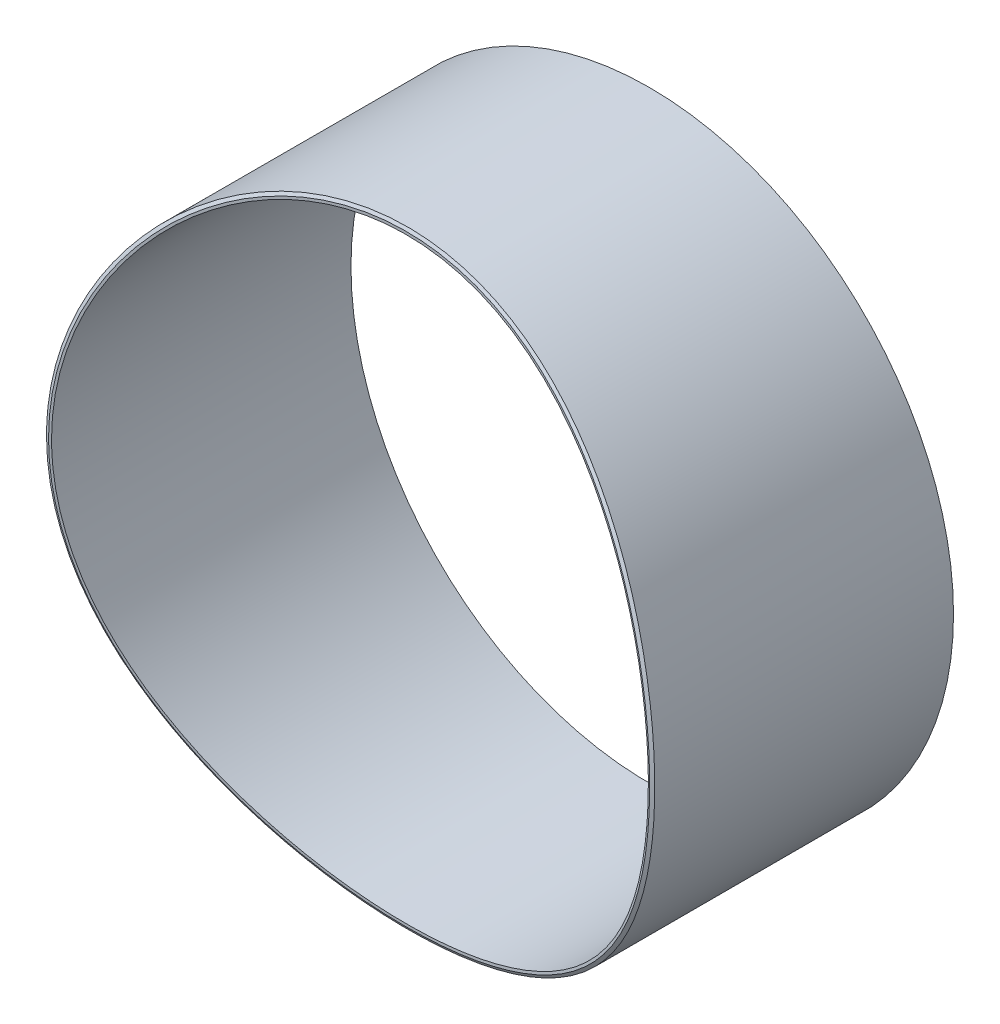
SolidWorks part; units mm, degrees
ref_plane "Front" through (0, 0, 0) normal (0, 0, 1) x (1, 0, 0)
ref_plane "Top" through (0, 0, 0) normal (0, 1, 0) x (1, 0, 0)
ref_plane "Right" through (0, 0, 0) normal (1, 0, 0) x (0, 0, -1)
sketch "Sketch1" plane through (0, 0, 0) normal (0, 0, 1) x (1, 0, 0)
  circle A0 centre (0, 0) radius 254
  circle A1 centre (0, 0) radius 249.2375
  dimension "D1" = 508
  dimension "D2" = 4.7625
extrude "Extrude1" add sketch "Sketch1" along normal blind 508
sketch "Sketch2" plane through (0, 0, 0) normal (0, 1, 0) x (1, 0, 0)
  line L2 (0, 182.5087) -> (0, -889) construction
  circle A0 centre (0, -889) radius 685.8
  point P0 (0, -203.2)
extrude "Cut-Extrude1" cut sketch "Sketch2" against normal through all and the other way through all
sketch "Sketch3" plane through (0, 0, 0) normal (1, 0, 0) x (0, 0, -1)
  line L0 (-4.1377, -254) -> (0, -250.825)
  line L1 (-203.2, -254) -> (0, -254) construction
  line L2 (0, -254) -> (0, 254) construction
  line L3 (0, -250.825) -> (0, -254)
  line L4 (0, -254) -> (-4.1377, -254)
  line L5 (35.2273, 0) -> (-261.4853, 0) construction
  dimension "D1" = 1.5875
  dimension "D2" = 37.5
chamfer "Chamfer1" distance 3.175 angle 45 1 edges at (250.8066, -40.1504, 250.7072)
ref_plane "Plane 2" through (0, 0, 88.9) normal (0, 0, 1) x (1, 0, 0)
ref_plane "Plane1" through (0, 0, 101.6) normal (0, 0, 1) x (1, 0, 0)
equation "\"D2@Sketch2\" = \"D1@Sketch1@shell 2<1>.Part@Vessel section 2<2>.Assembly\" / 2 - 1"
